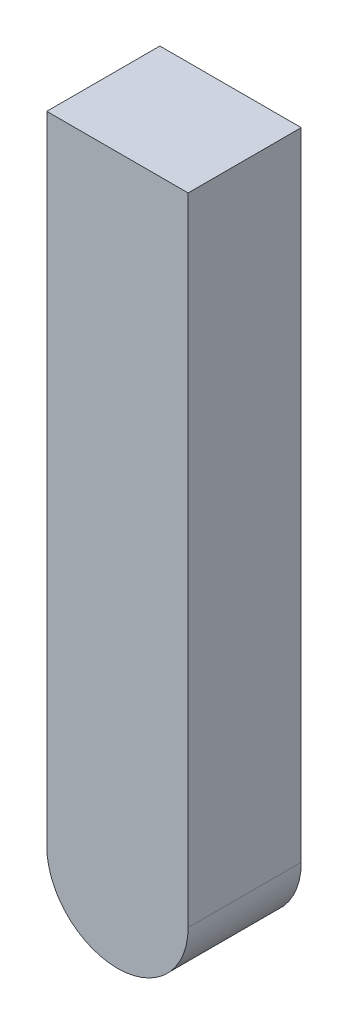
SolidWorks part; units mm, degrees
ref_plane "Plan1" through (0, 0, 0) normal (0, 0, 1) x (1, 0, 0)
ref_plane "Plan2" through (0, 0, 0) normal (0, 1, 0) x (1, 0, 0)
ref_plane "Plan3" through (0, 0, 0) normal (1, 0, 0) x (0, 0, -1)
sketch "Esquisse1" plane through (0, 0, 0) normal (0, 0, 1) x (1, 0, 0)
  line L0 (-1.25, 11.25) -> (-1.25, 0)
  line L1 (1.25, 11.25) -> (1.25, 0)
  line L3 (1.25, 11.25) -> (-1.25, 11.25)
  arc A0 (-1.25, 0) -> (1.25, 0) centre (0, 0) ccw
  dimension "D2" = 1.25
  dimension "D1" = 2.5
  dimension "D4" = 11.25
extrude "Base-Extrusion" add sketch "Esquisse1" along normal blind 2
